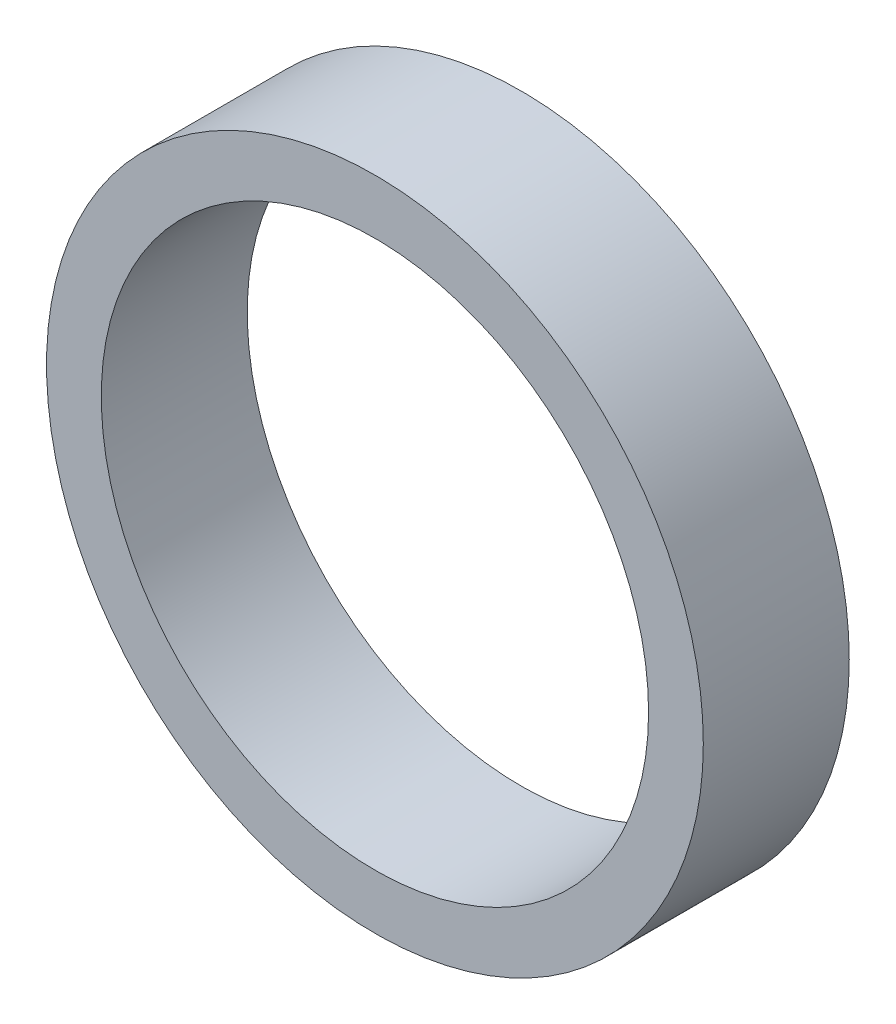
SolidWorks part; units mm, degrees
ref_plane "Front Plane" through (0, 0, 0) normal (0, 0, 1) x (1, 0, 0)
ref_plane "Top Plane" through (0, 0, 0) normal (0, 1, 0) x (1, 0, 0)
ref_plane "Right Plane" through (0, 0, 0) normal (1, 0, 0) x (0, 0, -1)
sketch "Skizze1" plane through (0, 0, 0) normal (0, 0, 1) x (1, 0, 0)
  circle A0 centre (0, 0) radius 18
  circle A1 centre (0, 0) radius 15
  dimension "D1" = 36
  dimension "D2" = 30
extrude "Aufsatz-Linear austragen1" add sketch "Skizze1" along normal blind 8
